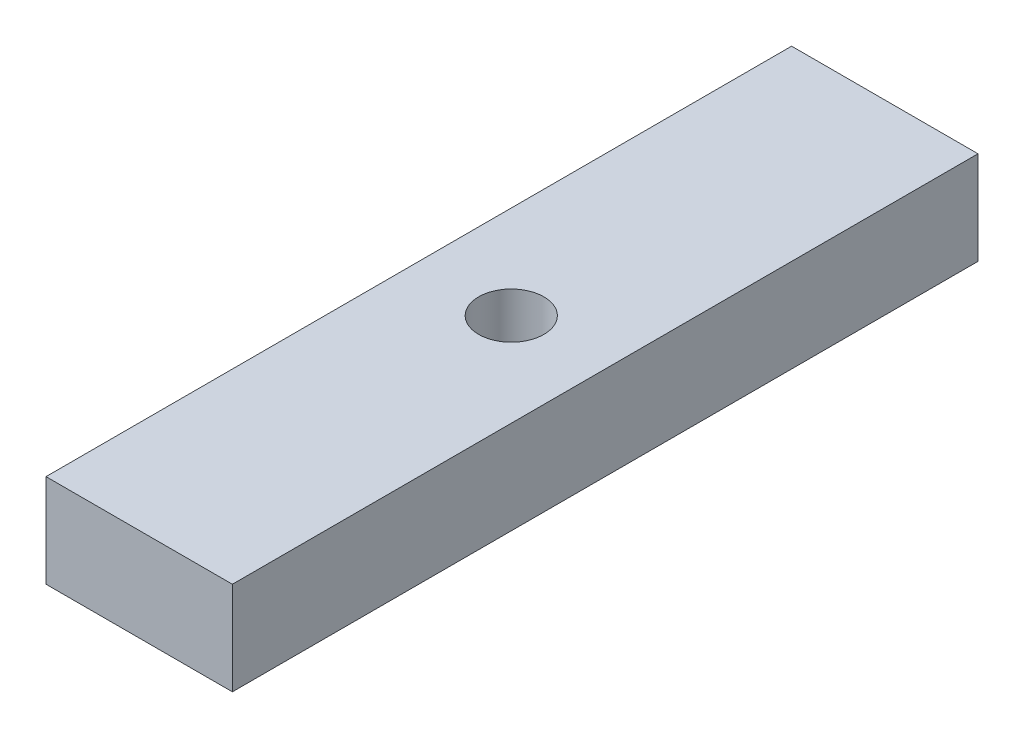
SolidWorks part; units mm, degrees
ref_plane "Plan de face" through (0, 0, 0) normal (0, 0, 1) x (1, 0, 0)
ref_plane "Plan de dessus" through (0, 0, 0) normal (0, 1, 0) x (1, 0, 0)
ref_plane "Plan de droite" through (0, 0, 0) normal (1, 0, 0) x (0, 0, -1)
sketch "Esquisse1" plane through (0, 0, 0) normal (0, 0, 1) x (1, 0, 0)
  line L1 (0, 0) -> (20, 0)
  line L2 (0, 0) -> (0, 10)
  line L3 (0, 10) -> (20, 10)
  line L4 (20, 0) -> (20, 10)
  dimension "D1" = 20
  dimension "D2" = 10
extrude "Extrusion1" add sketch "Esquisse1" against normal blind 80
sketch "Esquisse2" plane through (0, 10, 0) normal (0, 1, 0) x (-1, 0, 0)
  line L0 (-10, -83.1991) -> (-10, 3.3547) construction
  line L1 (5.7229, -40) -> (-24.4775, -40) construction
  circle A0 centre (-10, -39.9222) radius 3.5
  dimension "D1" = 7
extrude "Enlèv. mat.-Extru.1" cut sketch "Esquisse2" against normal blind 10
